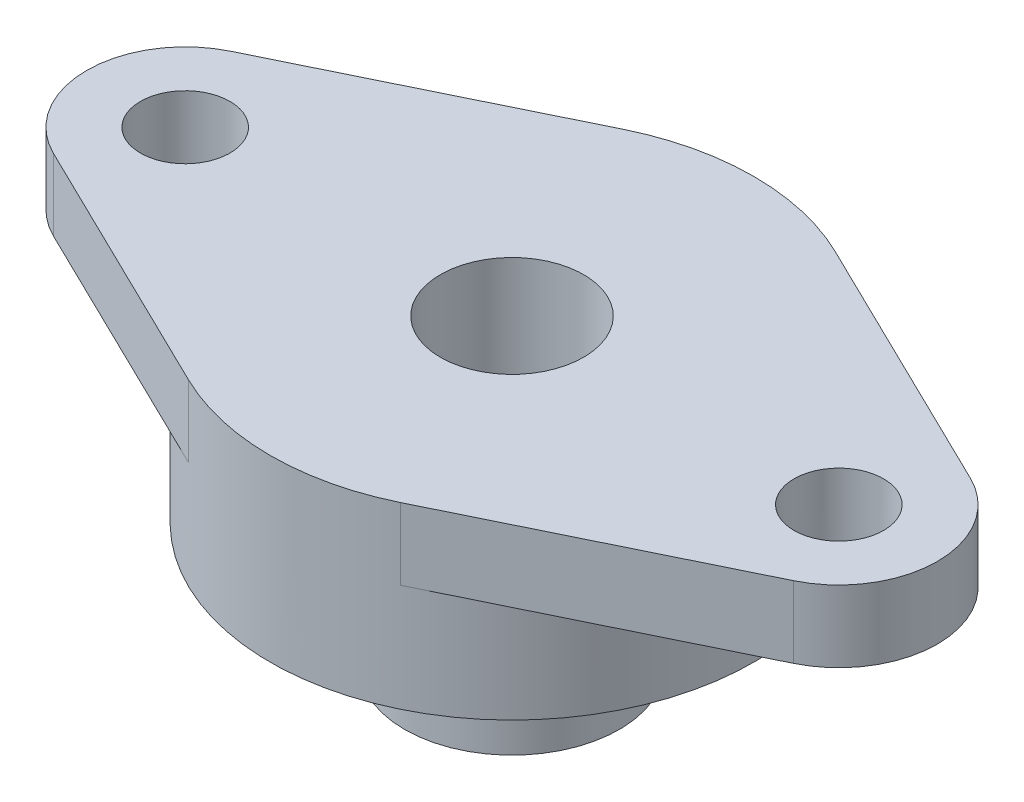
SolidWorks part; units mm, degrees
ref_plane "Alzado" through (0, 0, 0) normal (0, 0, 1) x (1, 0, 0)
ref_plane "Planta" through (0, 0, 0) normal (0, 1, 0) x (1, 0, 0)
ref_plane "Vista lateral" through (0, 0, 0) normal (1, 0, 0) x (0, 0, -1)
ref_plane "Plano1" through (0, 0, 0) normal (0, -1, 0) x (1, 0, 0)
sketch "Croquis1" plane through (0, 0, 0) normal (0, -1, 0) x (1, 0, 0)
  line L0 (20.661, 4.9434) -> (5.9178, 12.1338)
  line L1 (-5.9178, 12.1338) -> (-20.661, 4.9434)
  line L2 (-20.661, -4.9434) -> (-5.9178, -12.1338)
  line L3 (5.9178, -12.1338) -> (20.661, -4.9434)
  arc A0 (5.9178, 12.1338) -> (-5.9178, 12.1338) centre (0, 0) ccw
  arc A1 (-20.661, 4.9434) -> (-20.661, -4.9434) centre (-18.25, 0) ccw
  arc A2 (-5.9178, -12.1338) -> (5.9178, -12.1338) centre (0, 0) ccw
  arc A3 (20.661, -4.9434) -> (20.661, 4.9434) centre (18.25, 0) ccw
extrude "Saliente-Extruir1" add sketch "Croquis1" against normal blind 4
sketch "Croquis2" plane through (0, 0, 0) normal (0, -1, 0) x (1, 0, 0)
  circle A0 centre (0, 0) radius 13.5
extrude "Saliente-Extruir2" add sketch "Croquis2" along normal blind 6
hole_wizard "Diámetro de taladro Ø23.0 (23)1" positions "Croquis4" profile "Croquis3" hole size "Ø23.0" standard "Ansi Metric"
sketch "Croquis4" plane through (0, -6, 0) normal (0, -1, 0) x (-1, 0, 0)
  point P0 (0, 0)
sketch "Croquis3" plane through (0, -6, 0) normal (1, 0, 0) x (0, 0, -1)
  line L0 (0, 0) -> (0, 2)
  line L1 (0, 2) -> (11.5, 2)
  line L2 (11.5, 2) -> (11.5, 0)
  line L5 (11.5, 0) -> (0, 0)
  line L10 (0, 2) -> (-11.5, 2) construction
  line L11 (0, -6.35) -> (0, 107.95) construction
  dimension "Diámetro de taladro" = 23
  dimension "Profundidad de taladro" = 2
  dimension "Ángulo de perforador" = 180
ref_plane "Plano2" through (0, 0, 0) normal (0, 0, -1) x (-1, 0, 0)
sketch "Croquis5" plane through (0, 0, 0) normal (0, 0, -1) x (-1, 0, 0)
  line L0 (-6, -13) -> (0, -13)
  line L1 (0, -13) -> (0, -4)
  line L2 (0, -4) -> (-6, -4)
  line L3 (-6, -4) -> (-6, -13)
  line L4 (0, -13) -> (0, -4) construction
revolve "Revolución1" add sketch "Croquis5" angle 360 about L4
hole_wizard "Diámetro de taladro Ø8.0 (8)1" positions "Croquis7" profile "Croquis6" hole size "Ø8.0" standard "Ansi Metric"
sketch "Croquis7" plane through (0, 4, 0) normal (0, 1, 0) x (1, 0, 0)
  point P0 (0, 0)
sketch "Croquis6" plane through (0, 4, 0) normal (1, 0, 0) x (0, 0, 1)
  line L0 (0, 0) -> (0, 17)
  line L1 (0, 17) -> (4, 17)
  line L2 (4, 17) -> (4, 0)
  line L5 (4, 0) -> (0, 0)
  line L11 (0, -6.35) -> (0, 107.95) construction
  dimension "Diámetro de taladro hasta el siguiente" = 8
  dimension "Profundidad de taladro hasta el siguiente" = 17
ref_plane "Plano3" through (3.7997, 0, 0) normal (-1, 0, 0) x (0, 0, 1)
hole_wizard "Diámetro de taladro Ø2.5 (2.5)1" positions "Croquis9" profile "Croquis8" hole size "Ø2.5" standard "Ansi Metric"
sketch "Croquis9" plane through (3.7997, 0, 0) normal (-1, 0, 0) x (0, 0, 1)
  point P0 (0, -10.2927)
sketch "Croquis8" plane through (3.7997, -10.2927, 0) normal (0, 1, 0) x (0, 0, 1)
  line L0 (0, 0) -> (0, 19.9503)
  line L1 (0, 19.9503) -> (1.25, 19.9503)
  line L2 (1.25, 19.9503) -> (1.25, 0)
  line L5 (1.25, 0) -> (0, 0)
  line L11 (0, -6.35) -> (0, 107.95) construction
  dimension "Diámetro de taladro hasta el siguiente" = 2.5
  dimension "Profundidad de taladro hasta el siguiente" = 19.9503
ref_plane "Plano4" through (0, 0, -3.7997) normal (0, 0, 1) x (1, 0, 0)
hole_wizard "Diámetro de taladro Ø2.5 (2.5)2" positions "Croquis11" profile "Croquis10" hole size "Ø2.5" standard "Ansi Metric"
sketch "Croquis11" plane through (0, 0, -3.7997) normal (0, 0, 1) x (1, 0, 0)
  point P0 (0, -10.2927)
sketch "Croquis10" plane through (0, -10.2927, -3.7997) normal (1, 0, 0) x (0, -1, 0)
  line L0 (0, 0) -> (0, 9.7003)
  line L1 (0, 9.7003) -> (1.25, 9.7003)
  line L2 (1.25, 9.7003) -> (1.25, 0)
  line L5 (1.25, 0) -> (0, 0)
  line L11 (0, -6.35) -> (0, 107.95) construction
  dimension "Diámetro de taladro hasta el siguiente" = 2.5
  dimension "Profundidad de taladro hasta el siguiente" = 9.7003
hole_wizard "Diámetro de taladro Ø5.0 (5)1" positions "Croquis13" profile "Croquis12" hole size "Ø5.0" standard "Ansi Metric"
sketch "Croquis13" plane through (0, 4, 0) normal (0, 1, 0) x (1, 0, 0)
  point P0 (18.25, 0)
sketch "Croquis12" plane through (18.25, 4, 0) normal (1, 0, 0) x (0, 0, 1)
  line L0 (0, 0) -> (0, 17)
  line L1 (0, 17) -> (2.5, 17)
  line L2 (2.5, 17) -> (2.5, 0)
  line L5 (2.5, 0) -> (0, 0)
  line L11 (0, -6.35) -> (0, 107.95) construction
  dimension "Diámetro de taladro hasta el siguiente" = 5
  dimension "Profundidad de taladro hasta el siguiente" = 17
hole_wizard "Diámetro de taladro Ø5.0 (5)2" positions "Croquis15" profile "Croquis14" hole size "Ø5.0" standard "Ansi Metric"
sketch "Croquis15" plane through (0, 0, 0) normal (0, -1, 0) x (-1, 0, 0)
  point P0 (18.25, 0)
sketch "Croquis14" plane through (-18.25, 0, 0) normal (1, 0, 0) x (0, 0, -1)
  line L0 (0, 0) -> (0, 4)
  line L1 (0, 4) -> (2.5, 4)
  line L2 (2.5, 4) -> (2.5, 0)
  line L5 (2.5, 0) -> (0, 0)
  line L11 (0, -6.35) -> (0, 107.95) construction
  dimension "Diámetro de taladro hasta el siguiente" = 5
  dimension "Profundidad de taladro hasta el siguiente" = 4
